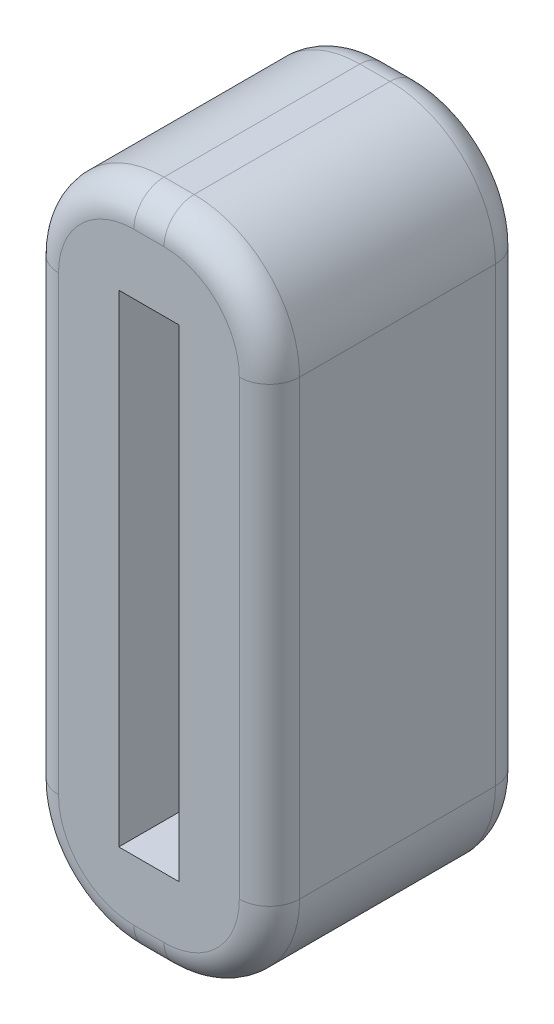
SolidWorks part; units mm, degrees
ref_plane "Front Plane" through (0, 0, 0) normal (0, 0, 1) x (1, 0, 0)
ref_plane "Top Plane" through (0, 0, 0) normal (0, 1, 0) x (1, 0, 0)
ref_plane "Right Plane" through (0, 0, 0) normal (1, 0, 0) x (0, 0, -1)
sketch "Sketch1" plane through (0, 0, 0) normal (0, 0, 1) x (1, 0, 0)
  line L0 (0, 0) -> (0, 8)
  line L1 (0, 8) -> (1, 8)
  line L2 (1, 8) -> (1, 0)
  line L3 (1, 0) -> (0, 0)
  line L4 (-1.5, 0.25) -> (-1.5, 7.75)
  line L5 (0.25, 9.5) -> (0.75, 9.5)
  line L6 (2.5, 7.75) -> (2.5, 0.25)
  line L7 (0.75, -1.5) -> (0.25, -1.5)
  line L8 (2.5, 9.5) -> (2.5, -1.5) construction
  line L9 (2.5, -1.5) -> (-1.5, -1.5) construction
  line L10 (-1.5, -1.5) -> (-1.5, 9.5) construction
  line L11 (-1.5, 9.5) -> (2.5, 9.5) construction
  arc A0 (2.5, 0.25) -> (0.75, -1.5) centre (0.75, 0.25) cw
  arc A1 (-1.5, 0.25) -> (0.25, -1.5) centre (0.25, 0.25) ccw
  arc A2 (0.75, 9.5) -> (2.5, 7.75) centre (0.75, 7.75) cw
  arc A3 (-1.5, 7.75) -> (0.25, 9.5) centre (0.25, 7.75) cw
  dimension "D4" = 1.75
  dimension "D1" = 1
  dimension "D2" = 8
  dimension "D3" = 1.5
extrude "Boss-Extrude1" add sketch "Sketch1" along normal blind 4.25
fillet "Fillet1" radius 0.5 16 edges at (1.9874, -0.9874, 0) (0.5, -1.5, 0) (-0.9874, -0.9874, 0) (-1.5, 4, 0) (-0.9874, 8.9874, 0) (0.5, 9.5, 0) (1.9874, 8.9874, 0) (1.9874, -0.9874, 4.25) (0.5, -1.5, 4.25) (-0.9874, -0.9874, 4.25) (-1.5, 4, 4.25) (-0.9874, 8.9874, 4.25) (0.5, 9.5, 4.25) (1.9874, 8.9874, 4.25) (2.5, 4, 0) (2.5, 4, 4.25)
